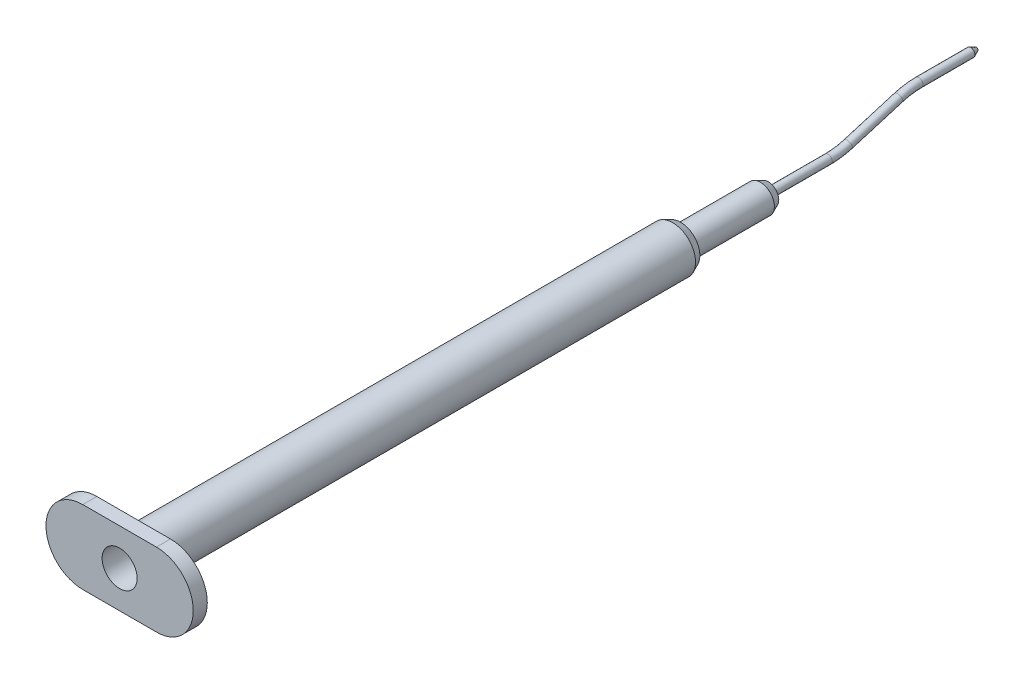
SolidWorks part; units mm, degrees
ref_plane "Ebene vorne" through (0, 0, 0) normal (0, 0, 1) x (1, 0, 0)
ref_plane "Ebene oben" through (0, 0, 0) normal (0, 1, 0) x (1, 0, 0)
ref_plane "Ebene rechts" through (0, 0, 0) normal (1, 0, 0) x (0, 0, -1)
sketch "Skizze1" plane through (0, 0, 0) normal (0, 0, 1) x (1, 0, 0)
  circle A0 centre (0, 0) radius 3.25
  circle A1 centre (0, 0) radius 2.5
  dimension "D1" = 6.5
  dimension "D2" = 5
extrude "Aufsatz-Linear austragen1" add sketch "Skizze1" against normal blind 75
sketch "Skizze3" plane through (0, 0, 0) normal (0, 0, 1) x (1, 0, 0)
  line L0 (-4.4255, 0) -> (7.8734, 0) construction
  line L1 (-5.25, 0) -> (5.25, 0) construction
  line L2 (-5.25, 5.25) -> (5.25, 5.25)
  line L3 (-5.25, -5.25) -> (5.25, -5.25)
  arc A0 (-5.25, 5.25) -> (-5.25, -5.25) centre (-5.25, 0) ccw
  arc A1 (5.25, -5.25) -> (5.25, 5.25) centre (5.25, 0) ccw
  point P5 (0, 0)
  dimension "D2" = 21
  dimension "D3" = 10.5
  dimension "D1" = 10.5
extrude "Aufsatz-Linear austragen2" add sketch "Skizze3" along normal blind 2
sketch "Skizze4" plane through (0, 0, 2) normal (0, 0, 1) x (1, 0, 0)
  circle A0 centre (0, 0) radius 2.5
  dimension "D1" = 5
extrude "Schnitt-Linear austragen1" cut sketch "Skizze4" against normal blind 3
sketch "Skizze6" plane through (0, 0, 0) normal (0, 0, -1) x (-1, 0, 0)
  line L0 (0, -11.1038) -> (0, 12.26) construction
ref_plane "Ebene2" through (0, 0, 0) normal (1, 0, 0) x (0, 0, -1)
sketch "Skizze7" plane through (0, 0, 0) normal (1, 0, 0) x (0, 0, -1)
  line L0 (-2, 0) -> (194.6945, 0) construction
  line L1 (-2, 5.25) -> (-2, -5.25) construction
  line L2 (75, -3.25) -> (78, -3.25)
  line L3 (78, -3.25) -> (78, -2)
  line L4 (78, -2) -> (90.5, -2)
  line L5 (90.5, -2) -> (90.5, 0)
  line L6 (75, 0) -> (75, -3.25)
  line L7 (75, 0) -> (90.5, 0)
  dimension "D1" = 6.5
  dimension "D2" = 4
  dimension "D3" = 3
  dimension "D4" = 12.5
revolve "Rotation2" add sketch "Skizze7" angle 360 about L0
sketch "Skizze8" plane through (0, 0, -90.5) normal (0, 0, -1) x (-1, 0, 0)
  circle A0 centre (0, 0) radius 1
  dimension "D1" = 2
extrude "Schnitt-Linear austragen2" cut sketch "Skizze8" against normal through all
sketch "Skizze9" plane through (0, 0, 0) normal (1, 0, 0) x (0, 0, -1)
  line L0 (-8.578, 0) -> (140.4535, 0) construction
  line L1 (90.5, 0) -> (99.0323, 0)
  line L2 (90.5, -2) -> (90.5, 2) construction
  line L3 (101.9058, 0.4217) -> (109.0942, 2.5783)
  line L4 (111.9677, 3) -> (120.5, 3)
  arc A0 (109.0942, 2.5783) -> (111.9677, 3) centre (111.9677, -7) cw
  arc A1 (99.0323, 0) -> (101.9058, 0.4217) centre (99.0323, 10) ccw
  point P11 (110.5, 3)
  point P14 (100.5, 0)
  dimension "D5" = 10
  dimension "D1" = 10
  dimension "D2" = 10
  dimension "D3" = 10
  dimension "D4" = 3
ref_plane "Ebene3" through (0, 0, -120.5) normal (0, 0, 1) x (1, 0, 0)
sketch "Skizze11" plane through (0, 0, -120.5) normal (0, 0, 1) x (1, 0, 0)
  circle A0 centre (0, 3.036) radius 0.6
  circle A1 centre (0, 3.036) radius 0.25
  dimension "D1" = 1.2
  dimension "D2" = 0.5
sweep "Austragung1" add profiles "Skizze11" path "Skizze9"
chamfer "Fase1" distance 0.5 angle 66 1 edges at (0.6, 3.036, -120.5)
chamfer "Fase2" distance 0.5 angle 66 1 edges at (2, 0, -90.5)
chamfer "Fase3" distance 0.5 angle 66 1 edges at (3.25, 0, -78)
